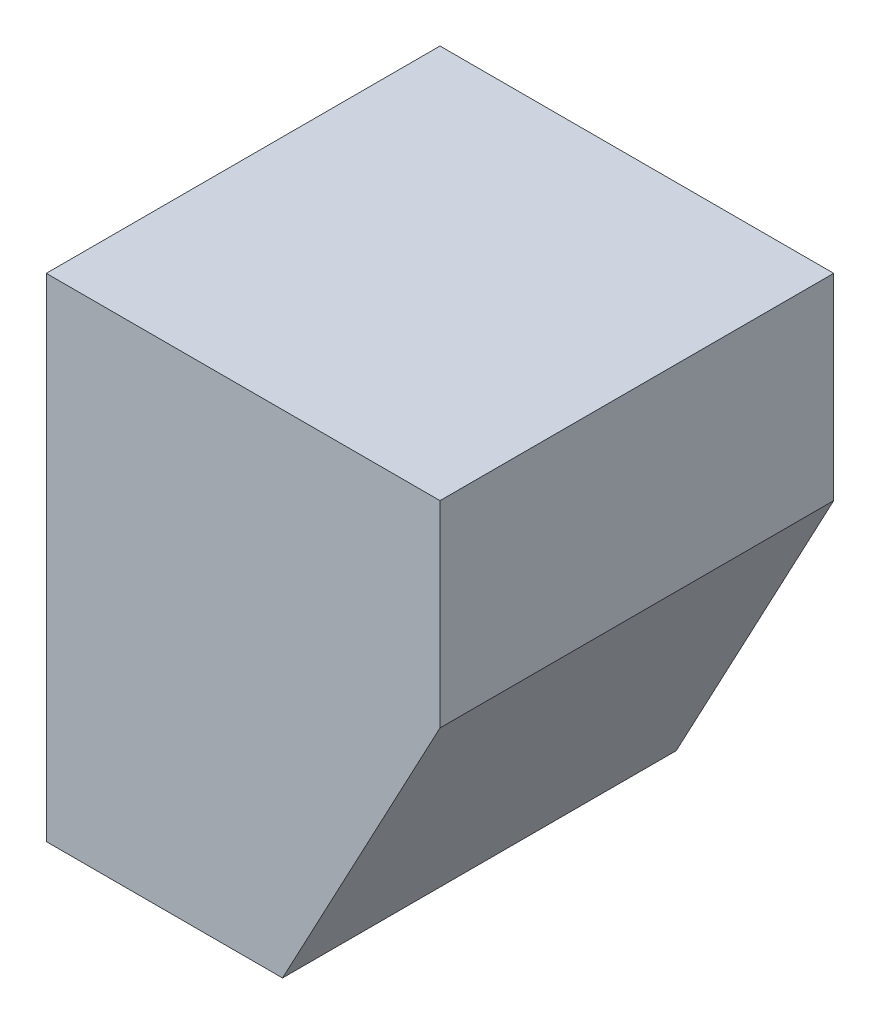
SolidWorks part; units mm, degrees
ref_plane "Plan de face" through (0, 0, 0) normal (0, 0, 1) x (1, 0, 0)
ref_plane "Plan de dessus" through (0, 0, 0) normal (0, 1, 0) x (1, 0, 0)
ref_plane "Plan de droite" through (0, 0, 0) normal (1, 0, 0) x (0, 0, -1)
sketch "Esquisse1" plane through (0, 0, 0) normal (0, 0, 1) x (1, 0, 0)
  line L0 (-42.8206, 43.3171) -> (-42.8206, 18.3171)
  line L1 (-42.8206, 18.3171) -> (-30.8206, 18.3171)
  line L2 (-30.8206, 18.3171) -> (-22.8206, 33.3171)
  line L3 (-22.8206, 33.3171) -> (-22.8206, 43.3171)
  line L4 (-22.8206, 43.3171) -> (-42.8206, 43.3171)
  dimension "D1" = 20
  dimension "D2" = 12
  dimension "D3" = 15
  dimension "D4" = 25
extrude "Boss.-Extru.1" add sketch "Esquisse1" along normal mid plane 20
